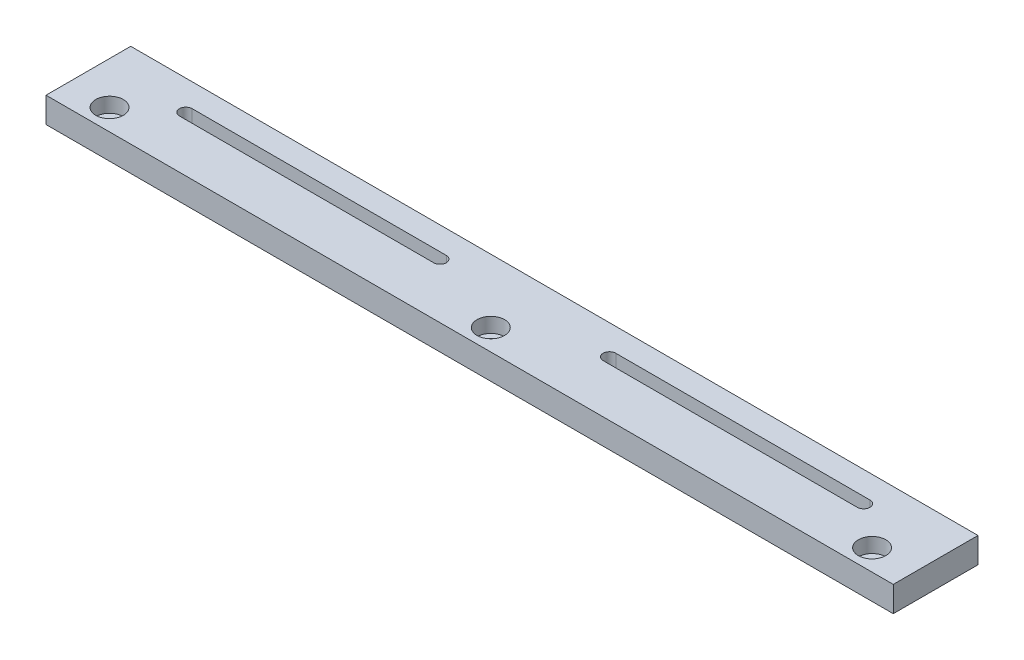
SolidWorks part; units mm, degrees
ref_plane "前视基准面" through (0, 0, 0) normal (0, 0, 1) x (1, 0, 0)
ref_plane "上视基准面" through (0, 0, 0) normal (0, 1, 0) x (1, 0, 0)
ref_plane "右视基准面" through (0, 0, 0) normal (1, 0, 0) x (0, 0, -1)
sketch "草图1" plane through (0, 0, 0) normal (0, 0, 1) x (1, 0, 0)
  line L0 (0, 0) -> (0, 6)
  line L1 (200, 0) -> (200, 6)
  line L2 (0, 0) -> (200, 0)
  line L3 (0, 6) -> (200, 6)
extrude "凸台-拉伸1" add sketch "草图1" along normal blind 20
sketch "草图2" plane through (0, 6, 0) normal (0, 1, 0) x (1, 0, 0)
  line L0 (20, -5.5) -> (80, -5.5)
  line L1 (20, -8.5) -> (80, -8.5)
  line L2 (120, -8.5) -> (180, -8.5)
  line L3 (120, -5.5) -> (180, -5.5)
  circle A0 centre (10, -15) radius 1.75
  circle A1 centre (100, -15) radius 1.75
  circle A2 centre (190, -15) radius 1.75
  arc A3 (20, -5.5) -> (20, -8.5) centre (20, -7) ccw
  arc A4 (80, -8.5) -> (80, -5.5) centre (80, -7) ccw
  arc A5 (120, -5.5) -> (120, -8.5) centre (120, -7) ccw
  arc A6 (180, -8.5) -> (180, -5.5) centre (180, -7) ccw
extrude "切除-拉伸1" cut sketch "草图2" against normal blind 20
sketch "草图3" plane through (0, 6, 0) normal (0, 1, 0) x (1, 0, 0)
  circle A0 centre (10, -15) radius 3.25
  circle A1 centre (100, -15) radius 3.25
  circle A2 centre (190, -15) radius 3.25
extrude "切除-拉伸2" cut sketch "草图3" against normal blind 3.5
